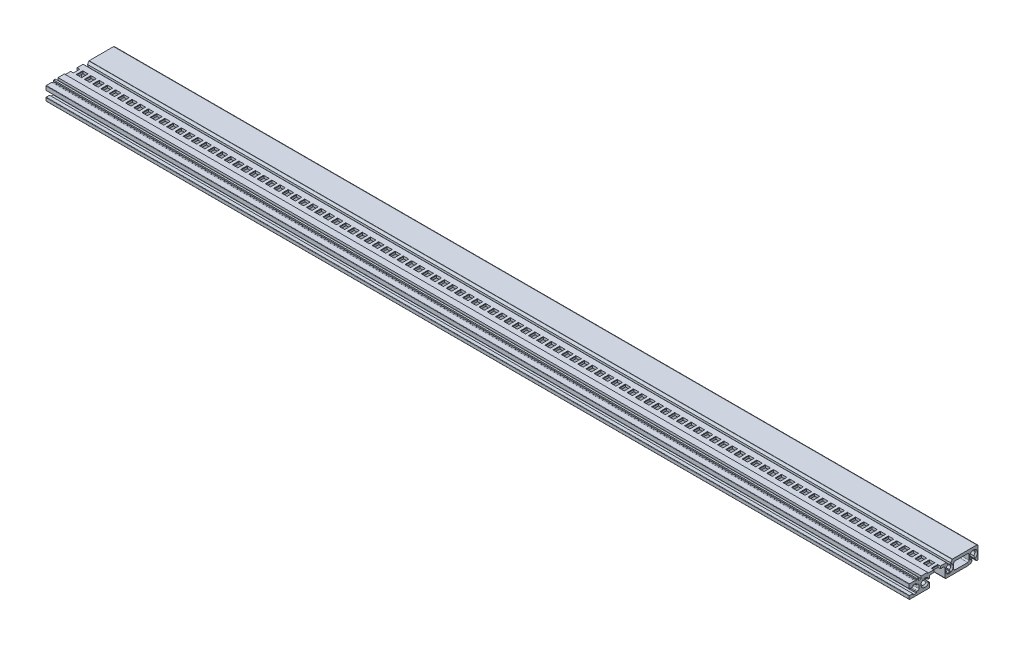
SolidWorks part; units mm, degrees
other "34566584"
ref_plane "前视基准面" through (0, 0, 0) normal (0, 0, 1) x (1, 0, 0)
ref_plane "上视基准面" through (0, 0, 0) normal (0, 1, 0) x (1, 0, 0)
ref_plane "右视基准面" through (0, 0, 0) normal (1, 0, 0) x (0, 0, -1)
imported_body "输入1"
sketch "草图1" plane through (215.9, 0, 0) normal (1, 0, 0) x (0, 0, -1)
  line L1 (-19.9416, 3.2237) -> (28.7259, 3.2237)
  line L2 (-19.9416, 3.2237) -> (-19.9416, -11.6337)
  line L3 (-19.9416, -11.6337) -> (28.7259, -11.6337)
  line L4 (28.7259, 3.2237) -> (28.7259, -11.6337)
extrude "切除-拉伸1" cut sketch "草图1" against normal up to vertex
sketch "草图2" plane through (193.9068, 0, 0) normal (1, 0, 0) x (0, 0, -1)
  line L0 (18.95, -6.6) -> (11.05, -6.6) construction
  line L1 (10.25, -5.8) -> (10.25, -2.6) construction
  line L2 (11.05, -1.8) -> (18.95, -1.8) construction
  line L3 (19.75, -2.6) -> (19.75, -5.8) construction
  line L4 (18.95, -6.6) -> (11.05, -6.6)
  line L5 (10.25, -5.8) -> (10.25, -2.6)
  line L6 (11.05, -1.8) -> (18.95, -1.8)
  line L7 (19.75, -2.6) -> (19.75, -5.8)
  line L50 (-12.05, -6.25) -> (-12.85, -6.25)
  line L51 (-12.85, -6.25) -> (-12.85, -7.1)
  line L52 (-12.85, -7.1) -> (-15.05, -7.1)
  line L53 (-15.05, -7.1) -> (-15.05, -6.25)
  line L54 (-15.05, -6.25) -> (-17.05, -6.25)
  line L55 (-17.25, -6.45) -> (-17.25, -8.2)
  line L56 (-17.05, -8.4) -> (-4.95, -8.4)
  line L57 (-4.75, -8.2) -> (-4.75, -5.45)
  line L58 (-5.25, -4.95) -> (-6.5, -4.95)
  line L59 (-6.5, -3.45) -> (-5.25, -3.45)
  line L60 (-4.75, -2.95) -> (-4.75, -2.3)
  line L61 (-3.95, -1.5) -> (3.95, -1.5)
  line L62 (4.75, -2.3) -> (4.75, -7.6)
  line L63 (5.55, -8.4) -> (19.3, -8.4)
  line L64 (19.3, -8.4) -> (19.3, -8.1)
  line L65 (19.3, -8.1) -> (20.7667, -8.1)
  line L66 (20.9399, -8) -> (21.575, -6.9)
  line L67 (21.575, -6.9) -> (21.575, -5.0408)
  line L68 (21.575, -3.3592) -> (21.575, -2.5571)
  line L69 (21.925, -1.7) -> (23.075, -1.7)
  line L70 (23.425, -2.5571) -> (23.425, -3.3592)
  line L71 (23.425, -5.0408) -> (23.425, -6.9)
  line L72 (23.425, -6.9) -> (24.2333, -8.3)
  line L73 (24.4065, -8.4) -> (25.05, -8.4)
  line L74 (25.25, -8.2) -> (25.25, -0.8)
  line L75 (24.45, 0) -> (9.4065, 0)
  line L76 (9.2333, -0.1) -> (8.425, -1.5)
  line L77 (8.425, -1.5) -> (8.425, -3.3592)
  line L78 (8.425, -5.0408) -> (8.425, -6.2)
  line L79 (8.225, -6.4) -> (6.775, -6.4)
  line L80 (6.575, -6.2) -> (6.575, -5.0408)
  line L81 (6.575, -3.3592) -> (6.575, -1.5)
  line L82 (6.575, -1.5) -> (5.7667, -0.1)
  line L83 (5.5935, 0) -> (-5.95, 0)
  line L84 (-5.95, 0) -> (-5.95, 0.6)
  line L85 (-5.95, 0.6) -> (-9.85, 0.6)
  line L86 (-9.85, 0.6) -> (-9.85, -0.8)
  line L87 (-10.05, -1) -> (-11.25, -1)
  line L88 (-11.45, -0.8) -> (-11.45, 0.6)
  line L89 (-11.45, 0.6) -> (-12.5, 0.6)
  line L90 (-12.5, 0.6) -> (-12.5, -0.1)
  line L91 (-12.7, -0.3) -> (-13.3, -0.3)
  line L92 (-13.6873, 0) -> (-17.05, 0)
  line L93 (-17.25, -0.2) -> (-17.25, -2.5)
  line L94 (-17.05, -2.7) -> (-15.05, -2.7)
  line L95 (-15.05, -2.7) -> (-15.05, -1.85)
  line L96 (-15.05, -1.85) -> (-12.85, -1.85)
  line L97 (-12.85, -1.85) -> (-12.85, -2.7)
  line L98 (-12.85, -2.7) -> (-12.05, -2.7)
  line L99 (-11.25, -3.5) -> (-11.25, -5.45)
  line L100 (-12.05, -6.25) -> (-12.85, -6.25)
  line L101 (-12.85, -6.25) -> (-12.85, -7.1)
  line L102 (-12.85, -7.1) -> (-15.05, -7.1)
  line L103 (-15.05, -7.1) -> (-15.05, -6.25)
  line L104 (-15.05, -6.25) -> (-17.05, -6.25)
  line L105 (-17.25, -6.45) -> (-17.25, -8.2)
  line L106 (-17.05, -8.4) -> (-4.95, -8.4)
  line L107 (-4.75, -8.2) -> (-4.75, -5.45)
  line L108 (-5.25, -4.95) -> (-6.5, -4.95)
  line L109 (-6.5, -3.45) -> (-5.25, -3.45)
  line L110 (-4.75, -2.95) -> (-4.75, -2.3)
  line L111 (-3.95, -1.5) -> (3.95, -1.5)
  line L112 (4.75, -2.3) -> (4.75, -7.6)
  line L113 (5.55, -8.4) -> (19.3, -8.4)
  line L114 (19.3, -8.4) -> (19.3, -8.1)
  line L115 (19.3, -8.1) -> (20.7667, -8.1)
  line L116 (20.9399, -8) -> (21.575, -6.9)
  line L117 (21.575, -6.9) -> (21.575, -5.0408)
  line L118 (21.575, -3.3592) -> (21.575, -2.5571)
  line L119 (21.925, -1.7) -> (23.075, -1.7)
  line L120 (23.425, -2.5571) -> (23.425, -3.3592)
  line L121 (23.425, -5.0408) -> (23.425, -6.9)
  line L122 (23.425, -6.9) -> (24.2333, -8.3)
  line L123 (24.4065, -8.4) -> (25.05, -8.4)
  line L124 (25.25, -8.2) -> (25.25, -0.8)
  line L125 (24.45, 0) -> (9.4065, 0)
  line L126 (9.2333, -0.1) -> (8.425, -1.5)
  line L127 (8.425, -1.5) -> (8.425, -3.3592)
  line L128 (8.425, -5.0408) -> (8.425, -6.2)
  line L129 (8.225, -6.4) -> (6.775, -6.4)
  line L130 (6.575, -6.2) -> (6.575, -5.0408)
  line L131 (6.575, -3.3592) -> (6.575, -1.5)
  line L132 (6.575, -1.5) -> (5.7667, -0.1)
  line L133 (5.5935, 0) -> (-5.95, 0)
  line L134 (-5.95, 0) -> (-5.95, 0.6)
  line L135 (-5.95, 0.6) -> (-9.85, 0.6)
  line L136 (-9.85, 0.6) -> (-9.85, -0.8)
  line L137 (-10.05, -1) -> (-11.25, -1)
  line L138 (-11.45, -0.8) -> (-11.45, 0.6)
  line L139 (-11.45, 0.6) -> (-12.5, 0.6)
  line L140 (-12.5, 0.6) -> (-12.5, -0.1)
  line L141 (-12.7, -0.3) -> (-13.3, -0.3)
  line L142 (-13.6873, 0) -> (-17.05, 0)
  line L143 (-17.25, -0.2) -> (-17.25, -2.5)
  line L144 (-17.05, -2.7) -> (-15.05, -2.7)
  line L145 (-15.05, -2.7) -> (-15.05, -1.85)
  line L146 (-15.05, -1.85) -> (-12.85, -1.85)
  line L147 (-12.85, -1.85) -> (-12.85, -2.7)
  line L148 (-12.85, -2.7) -> (-12.05, -2.7)
  line L149 (-11.25, -3.5) -> (-11.25, -5.45)
  arc A0 (10.25, -5.8) -> (11.05, -6.6) centre (11.05, -5.8) ccw construction
  arc A1 (11.05, -1.8) -> (10.25, -2.6) centre (11.05, -2.6) ccw construction
  arc A2 (19.75, -2.6) -> (18.95, -1.8) centre (18.95, -2.6) ccw construction
  arc A3 (18.95, -6.6) -> (19.75, -5.8) centre (18.95, -5.8) ccw construction
  arc A4 (10.25, -5.8) -> (11.05, -6.6) centre (11.05, -5.8) ccw
  arc A5 (11.05, -1.8) -> (10.25, -2.6) centre (11.05, -2.6) ccw
  arc A6 (19.75, -2.6) -> (18.95, -1.8) centre (18.95, -2.6) ccw
  arc A7 (18.95, -6.6) -> (19.75, -5.8) centre (18.95, -5.8) ccw
  arc A32 (-17.05, -6.25) -> (-17.25, -6.45) centre (-17.05, -6.45) ccw
  arc A33 (-17.25, -8.2) -> (-17.05, -8.4) centre (-17.05, -8.2) ccw
  arc A34 (-4.95, -8.4) -> (-4.75, -8.2) centre (-4.95, -8.2) ccw
  arc A35 (-4.75, -5.45) -> (-5.25, -4.95) centre (-5.25, -5.45) ccw
  arc A36 (-6.5, -3.45) -> (-6.5, -4.95) centre (-7.5, -4.2) ccw
  arc A37 (-5.25, -3.45) -> (-4.75, -2.95) centre (-5.25, -2.95) ccw
  arc A38 (-3.95, -1.5) -> (-4.75, -2.3) centre (-3.95, -2.3) ccw
  arc A39 (4.75, -2.3) -> (3.95, -1.5) centre (3.95, -2.3) ccw
  arc A40 (4.75, -7.6) -> (5.55, -8.4) centre (5.55, -7.6) ccw
  arc A41 (20.7667, -8.1) -> (20.9399, -8) centre (20.7667, -7.9) ccw
  arc A42 (21.575, -3.3592) -> (21.575, -5.0408) centre (22.5, -4.2) ccw
  arc A43 (21.925, -1.7) -> (21.575, -2.5571) centre (21.925, -2.2) ccw
  arc A44 (23.425, -2.5571) -> (23.075, -1.7) centre (23.075, -2.2) ccw
  arc A45 (23.425, -5.0408) -> (23.425, -3.3592) centre (22.5, -4.2) ccw
  arc A46 (24.2333, -8.3) -> (24.4065, -8.4) centre (24.4065, -8.2) ccw
  arc A47 (25.05, -8.4) -> (25.25, -8.2) centre (25.05, -8.2) ccw
  arc A48 (25.25, -0.8) -> (24.45, 0) centre (24.45, -0.8) ccw
  arc A49 (9.4065, 0) -> (9.2333, -0.1) centre (9.4065, -0.2) ccw
  arc A50 (8.425, -5.0408) -> (8.425, -3.3592) centre (7.5, -4.2) ccw
  arc A51 (8.225, -6.4) -> (8.425, -6.2) centre (8.225, -6.2) ccw
  arc A52 (6.575, -6.2) -> (6.775, -6.4) centre (6.775, -6.2) ccw
  arc A53 (6.575, -3.3592) -> (6.575, -5.0408) centre (7.5, -4.2) ccw
  arc A54 (5.7667, -0.1) -> (5.5935, 0) centre (5.5935, -0.2) ccw
  arc A55 (-10.05, -1) -> (-9.85, -0.8) centre (-10.05, -0.8) ccw
  arc A56 (-11.45, -0.8) -> (-11.25, -1) centre (-11.25, -0.8) ccw
  arc A57 (-12.7, -0.3) -> (-12.5, -0.1) centre (-12.7, -0.1) ccw
  arc A58 (-13.4936, -0.15) -> (-13.3, -0.3) centre (-13.3, -0.1) ccw
  arc A59 (-13.4936, -0.15) -> (-13.6873, 0) centre (-13.6873, -0.2) ccw
  arc A60 (-17.05, 0) -> (-17.25, -0.2) centre (-17.05, -0.2) ccw
  arc A61 (-17.25, -2.5) -> (-17.05, -2.7) centre (-17.05, -2.5) ccw
  arc A62 (-11.25, -3.5) -> (-12.05, -2.7) centre (-12.05, -3.5) ccw
  arc A63 (-12.05, -6.25) -> (-11.25, -5.45) centre (-12.05, -5.45) ccw
  arc A64 (-17.05, -6.25) -> (-17.25, -6.45) centre (-17.05, -6.45) ccw
  arc A65 (-17.25, -8.2) -> (-17.05, -8.4) centre (-17.05, -8.2) ccw
  arc A66 (-4.95, -8.4) -> (-4.75, -8.2) centre (-4.95, -8.2) ccw
  arc A67 (-4.75, -5.45) -> (-5.25, -4.95) centre (-5.25, -5.45) ccw
  arc A68 (-6.5, -3.45) -> (-6.5, -4.95) centre (-7.5, -4.2) ccw
  arc A69 (-5.25, -3.45) -> (-4.75, -2.95) centre (-5.25, -2.95) ccw
  arc A70 (-3.95, -1.5) -> (-4.75, -2.3) centre (-3.95, -2.3) ccw
  arc A71 (4.75, -2.3) -> (3.95, -1.5) centre (3.95, -2.3) ccw
  arc A72 (4.75, -7.6) -> (5.55, -8.4) centre (5.55, -7.6) ccw
  arc A73 (20.7667, -8.1) -> (20.9399, -8) centre (20.7667, -7.9) ccw
  arc A74 (21.575, -3.3592) -> (21.575, -5.0408) centre (22.5, -4.2) ccw
  arc A75 (21.925, -1.7) -> (21.575, -2.5571) centre (21.925, -2.2) ccw
  arc A76 (23.425, -2.5571) -> (23.075, -1.7) centre (23.075, -2.2) ccw
  arc A77 (23.425, -5.0408) -> (23.425, -3.3592) centre (22.5, -4.2) ccw
  arc A78 (24.2333, -8.3) -> (24.4065, -8.4) centre (24.4065, -8.2) ccw
  arc A79 (25.05, -8.4) -> (25.25, -8.2) centre (25.05, -8.2) ccw
  arc A80 (25.25, -0.8) -> (24.45, 0) centre (24.45, -0.8) ccw
  arc A81 (9.4065, 0) -> (9.2333, -0.1) centre (9.4065, -0.2) ccw
  arc A82 (8.425, -5.0408) -> (8.425, -3.3592) centre (7.5, -4.2) ccw
  arc A83 (8.225, -6.4) -> (8.425, -6.2) centre (8.225, -6.2) ccw
  arc A84 (6.575, -6.2) -> (6.775, -6.4) centre (6.775, -6.2) ccw
  arc A85 (6.575, -3.3592) -> (6.575, -5.0408) centre (7.5, -4.2) ccw
  arc A86 (5.7667, -0.1) -> (5.5935, 0) centre (5.5935, -0.2) ccw
  arc A87 (-10.05, -1) -> (-9.85, -0.8) centre (-10.05, -0.8) ccw
  arc A88 (-11.45, -0.8) -> (-11.25, -1) centre (-11.25, -0.8) ccw
  arc A89 (-12.7, -0.3) -> (-12.5, -0.1) centre (-12.7, -0.1) ccw
  arc A90 (-13.4936, -0.15) -> (-13.3, -0.3) centre (-13.3, -0.1) ccw
  arc A91 (-13.4936, -0.15) -> (-13.6873, 0) centre (-13.6873, -0.2) ccw
  arc A92 (-17.05, 0) -> (-17.25, -0.2) centre (-17.05, -0.2) ccw
  arc A93 (-17.25, -2.5) -> (-17.05, -2.7) centre (-17.05, -2.5) ccw
  arc A94 (-11.25, -3.5) -> (-12.05, -2.7) centre (-12.05, -3.5) ccw
  arc A95 (-12.05, -6.25) -> (-11.25, -5.45) centre (-12.05, -5.45) ccw
  dimension "D1" = 0
extrude "凸台-拉伸1" add sketch "草图2" along normal blind 123.59
sketch "草图3" plane through (317.4968, 0, 0) normal (1, 0, 0) x (0, 0, -1)
  circle A0 centre (-7.5, -4.2) radius 1.65
  circle A1 centre (7.5, -4.2) radius 1.65
  circle A2 centre (22.5, -4.2) radius 1.65
extrude "切除-拉伸2" cut sketch "草图3" against normal blind 15.02
chamfer "倒角1" distance 0.85 angle 45 5 edges at (317.4968, -4.2, -20.85) (317.4968, -4.2, -24.15) (317.4968, -4.2, -9.15) (317.4968, -4.2, -5.85) (317.4968, -4.2, 9.15)
sketch "草图4" plane through (0, 0, 0) normal (0, 1, 0) x (1, 0, 0)
  line L0 (192, -2) -> (192, 2) construction
  line L1 (194.08, 2) -> (197.08, 2)
  line L2 (194.08, 2) -> (194.08, -2)
  line L3 (194.08, -2) -> (197.08, -2)
  line L4 (197.08, 2) -> (197.08, -2)
  line L5 (199.16, -2) -> (202.16, -2)
  line L6 (199.16, 2) -> (199.16, -2)
  line L7 (199.16, 2) -> (202.16, 2)
  line L8 (202.16, 2) -> (202.16, -2)
  line L9 (204.24, -2) -> (207.24, -2)
  line L10 (204.24, 2) -> (204.24, -2)
  line L11 (204.24, 2) -> (207.24, 2)
  line L12 (207.24, 2) -> (207.24, -2)
  line L13 (209.32, -2) -> (212.32, -2)
  line L14 (209.32, 2) -> (209.32, -2)
  line L15 (209.32, 2) -> (212.32, 2)
  line L16 (212.32, 2) -> (212.32, -2)
  line L17 (214.4, -2) -> (217.4, -2)
  line L18 (214.4, 2) -> (214.4, -2)
  line L19 (214.4, 2) -> (217.4, 2)
  line L20 (217.4, 2) -> (217.4, -2)
  line L21 (219.48, -2) -> (222.48, -2)
  line L22 (219.48, 2) -> (219.48, -2)
  line L23 (219.48, 2) -> (222.48, 2)
  line L24 (222.48, 2) -> (222.48, -2)
  line L25 (224.56, -2) -> (227.56, -2)
  line L26 (224.56, 2) -> (224.56, -2)
  line L27 (224.56, 2) -> (227.56, 2)
  line L28 (227.56, 2) -> (227.56, -2)
  line L29 (229.64, -2) -> (232.64, -2)
  line L30 (229.64, 2) -> (229.64, -2)
  line L31 (229.64, 2) -> (232.64, 2)
  line L32 (232.64, 2) -> (232.64, -2)
  line L33 (234.72, -2) -> (237.72, -2)
  line L34 (234.72, 2) -> (234.72, -2)
  line L35 (234.72, 2) -> (237.72, 2)
  line L36 (237.72, 2) -> (237.72, -2)
  line L37 (239.8, -2) -> (242.8, -2)
  line L38 (239.8, 2) -> (239.8, -2)
  line L39 (239.8, 2) -> (242.8, 2)
  line L40 (242.8, 2) -> (242.8, -2)
  line L41 (244.88, -2) -> (247.88, -2)
  line L42 (244.88, 2) -> (244.88, -2)
  line L43 (244.88, 2) -> (247.88, 2)
  line L44 (247.88, 2) -> (247.88, -2)
  line L45 (249.96, -2) -> (252.96, -2)
  line L46 (249.96, 2) -> (249.96, -2)
  line L47 (249.96, 2) -> (252.96, 2)
  line L48 (252.96, 2) -> (252.96, -2)
  line L49 (255.04, -2) -> (258.04, -2)
  line L50 (255.04, 2) -> (255.04, -2)
  line L51 (255.04, 2) -> (258.04, 2)
  line L52 (258.04, 2) -> (258.04, -2)
  line L53 (260.12, -2) -> (263.12, -2)
  line L54 (260.12, 2) -> (260.12, -2)
  line L55 (260.12, 2) -> (263.12, 2)
  line L56 (263.12, 2) -> (263.12, -2)
  line L57 (265.2, -2) -> (268.2, -2)
  line L58 (265.2, 2) -> (265.2, -2)
  line L59 (265.2, 2) -> (268.2, 2)
  line L60 (268.2, 2) -> (268.2, -2)
  line L61 (270.28, -2) -> (273.28, -2)
  line L62 (270.28, 2) -> (270.28, -2)
  line L63 (270.28, 2) -> (273.28, 2)
  line L64 (273.28, 2) -> (273.28, -2)
  line L65 (275.36, -2) -> (278.36, -2)
  line L66 (275.36, 2) -> (275.36, -2)
  line L67 (275.36, 2) -> (278.36, 2)
  line L68 (278.36, 2) -> (278.36, -2)
  line L69 (280.44, -2) -> (283.44, -2)
  line L70 (280.44, 2) -> (280.44, -2)
  line L71 (280.44, 2) -> (283.44, 2)
  line L72 (283.44, 2) -> (283.44, -2)
  line L73 (285.52, -2) -> (288.52, -2)
  line L74 (285.52, 2) -> (285.52, -2)
  line L75 (285.52, 2) -> (288.52, 2)
  line L76 (288.52, 2) -> (288.52, -2)
  line L77 (290.6, -2) -> (293.6, -2)
  line L78 (290.6, 2) -> (290.6, -2)
  line L79 (290.6, 2) -> (293.6, 2)
  line L80 (293.6, 2) -> (293.6, -2)
  line L81 (295.68, -2) -> (298.68, -2)
  line L82 (295.68, 2) -> (295.68, -2)
  line L83 (295.68, 2) -> (298.68, 2)
  line L84 (298.68, 2) -> (298.68, -2)
  line L85 (300.76, -2) -> (303.76, -2)
  line L86 (300.76, 2) -> (300.76, -2)
  line L87 (300.76, 2) -> (303.76, 2)
  line L88 (303.76, 2) -> (303.76, -2)
  line L89 (305.84, -2) -> (308.84, -2)
  line L90 (305.84, 2) -> (305.84, -2)
  line L91 (305.84, 2) -> (308.84, 2)
  line L92 (308.84, 2) -> (308.84, -2)
  line L93 (310.92, -2) -> (313.92, -2)
  line L94 (310.92, 2) -> (310.92, -2)
  line L95 (310.92, 2) -> (313.92, 2)
  line L96 (313.92, 2) -> (313.92, -2)
  line L97 (316, -2) -> (319, -2)
  line L98 (316, 2) -> (316, -2)
  line L99 (316, 2) -> (319, 2)
  line L100 (319, 2) -> (319, -2)
  dimension "D1" = 3
  dimension "D2" = 5.08
  dimension "D3" = 25
extrude "切除-拉伸3" cut sketch "草图4" against normal through all
sketch "草图5" plane through (0, 0, -2) normal (0, 0, 1) x (1, 0, 0)
  line L0 (194.08, 0) -> (193.91, 0)
  line L1 (193.91, 0) -> (194.08, -0.3)
  line L2 (194.08, -1.5) -> (194.08, 0) construction
  line L3 (194.08, -0.3) -> (194.08, 0)
  line L4 (197.08, 0) -> (197.25, 0)
  line L5 (197.25, 0) -> (197.08, -0.3)
  line L6 (197.08, -1.5) -> (197.08, 0) construction
  line L7 (197.08, -0.3) -> (197.08, 0)
  dimension "D1" = 0.17
  dimension "D2" = 0.3
  dimension "D3" = 0.17
  dimension "D4" = 0.3
extrude "切除-拉伸4" cut sketch "草图5" along normal up to surface (4 mm away)
pattern_linear "阵列(线性)1" count 25 spacing 5.08 along (1, 0, 0) of "切除-拉伸4"
